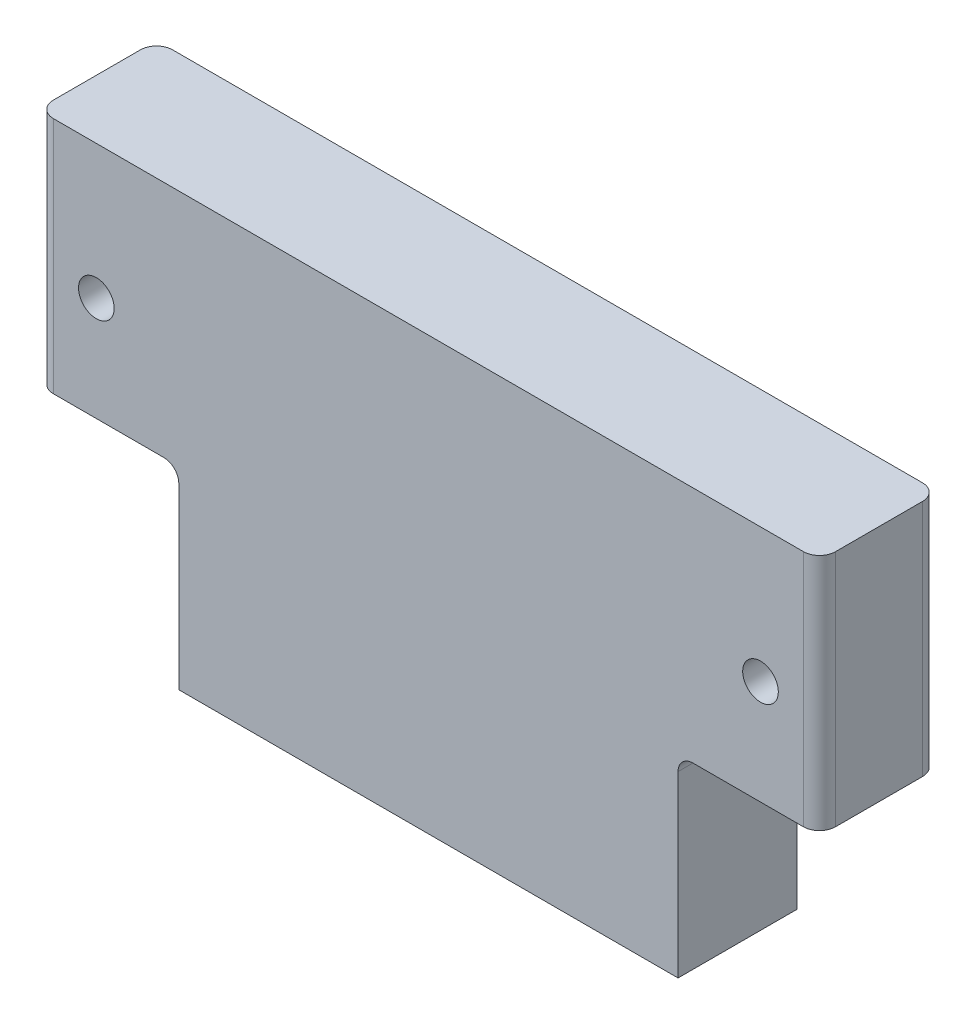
SolidWorks part; units mm, degrees
ref_plane "Front Plane" through (0, 0, 0) normal (0, 0, 1) x (1, 0, 0)
ref_plane "Top Plane" through (0, 0, 0) normal (0, 1, 0) x (1, 0, 0)
ref_plane "Right Plane" through (0, 0, 0) normal (1, 0, 0) x (0, 0, -1)
sketch "Sketch1" plane through (0, 0, 0) normal (0, 0, 1) x (1, 0, 0)
  line L1 (-41.6814, 12.7) -> (41.6814, 12.7)
  line L2 (-41.6814, 12.7) -> (-41.6814, -12.7)
  line L3 (-41.6814, -12.7) -> (41.6814, -12.7)
  line L4 (41.6814, 12.7) -> (41.6814, -12.7)
  line L5 (-41.6814, 12.7) -> (41.6814, -12.7) construction
  line L6 (-41.6814, -12.7) -> (41.6814, 12.7) construction
  line L7 (-41.8084, -12.7) -> (-41.8084, 12.7) construction
  point P0 (0, 0)
  dimension "D1" = 25.4
  dimension "D2" = 0.127
extrude "Boss-Extrude1" add sketch "Sketch1" along normal mid plane 12.7
hole_wizard "#10-24 Tapped Hole1" positions "Sketch4" profile "Sketch5" tap size "#10-24" standard "ANSI Inch"
sketch "Sketch4" plane through (0, 0, 6.35) normal (0, 0, 1) x (1, 0, 0)
  point P0 (-35.3949, -1.5875)
  point P10 (35.3949, -1.5875)
sketch "Sketch5" plane through (-35.3949, -1.5875, 6.35) normal (1, 0, 0) x (0, -1, 0)
  line L0 (0, 0) -> (0, 12.7)
  line L1 (0, 12.7) -> (1.8986, 12.7)
  line L2 (1.8986, 12.7) -> (1.8986, 0)
  line L5 (1.8986, 0) -> (0, 0)
  line L11 (0, -6.35) -> (0, 107.95) construction
  dimension "Thru Tap Drill Dia." = 3.7973
  dimension "Thru Tap Drill Depth" = 12.7
sketch "Sketch6" plane through (0, 0, 6.35) normal (0, 0, 1) x (1, 0, 0)
  line L0 (-41.6814, -12.7) -> (41.6814, -12.7) construction
  line L1 (-26.6065, -12.7) -> (26.6065, -12.7)
  line L2 (-26.6065, -12.7) -> (-26.6065, -33.3375)
  line L3 (-26.6065, -33.3375) -> (26.6065, -33.3375)
  line L4 (26.6065, -12.7) -> (26.6065, -33.3375)
  line L8 (-41.6814, 12.7) -> (-41.6814, -12.7) construction
  line L9 (0, -33.3375) -> (0, 12.7) construction
  line L10 (41.6814, 12.7) -> (-41.6814, 12.7) construction
  dimension "D1" = 15.0749
  dimension "D2" = 20.6375
extrude "Boss-Extrude2" add sketch "Sketch6" against normal up to surface (12.7 mm away)
fillet "Fillet1" radius 1.7145 4 edges at (-41.6814, 0, -6.35) (-41.6814, 0, 6.35) (41.6814, 0, -6.35) (41.6814, 0, 6.35)
fillet "Fillet2" radius 1.5875 2 edges at (-26.6065, -12.7, 0) (26.6065, -12.7, 0)
